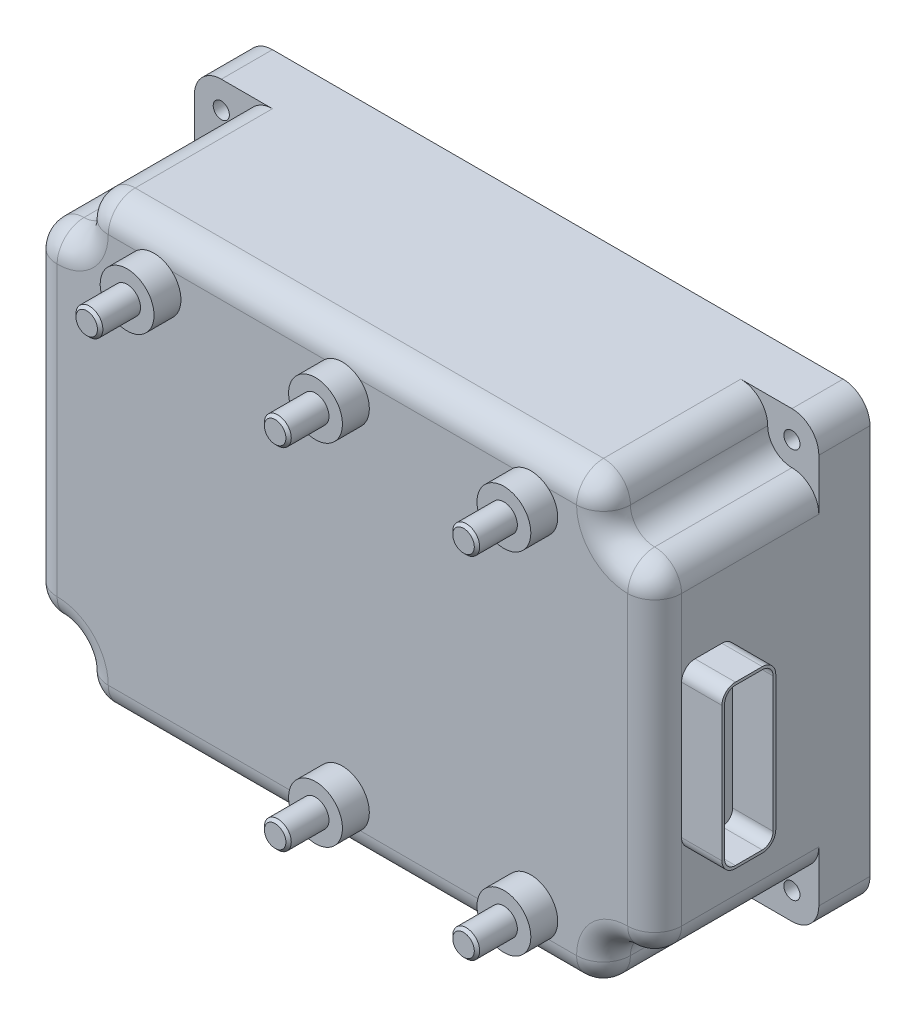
SolidWorks part; units mm, degrees
ref_plane "Face" through (0, 0, 0) normal (0, 0, 1) x (1, 0, 0)
ref_plane "Dessus" through (0, 0, 0) normal (0, 1, 0) x (1, 0, 0)
ref_plane "Droite" through (0, 0, 0) normal (1, 0, 0) x (0, 0, -1)
sketch "Esquisse1" plane through (0, 0, 0) normal (0, 0, 1) x (1, 0, 0)
  line L1 (-106, 82.5) -> (106, 82.5)
  line L2 (-116, 72.5) -> (-116, -72.5)
  line L3 (-106, -82.5) -> (106, -82.5)
  line L4 (116, 72.5) -> (116, -72.5)
  circle A0 centre (-106, 72.5) radius 3
  circle A1 centre (-106, -72.5) radius 3
  circle A2 centre (106, -72.5) radius 3
  circle A3 centre (106, 72.5) radius 3
  arc A4 (-116, 72.5) -> (-106, 82.5) centre (-106, 72.5) cw
  arc A5 (-106, -82.5) -> (-116, -72.5) centre (-106, -72.5) cw
  arc A6 (116, -72.5) -> (106, -82.5) centre (106, -72.5) cw
  arc A7 (106, 82.5) -> (116, 72.5) centre (106, 72.5) cw
  point P15 (-116, 82.5)
  point P18 (-116, -82.5)
  point P23 (116, 82.5)
  dimension "D5" = 6
  dimension "D10" = 10
  dimension "D1" = 232
  dimension "D2" = 165
  dimension "D3" = 116
  dimension "D4" = 82.5
  dimension "D6" = 212
  dimension "D7" = 106
  dimension "D8" = 145
  dimension "D9" = 72.5
extrude "Extrusion1" add sketch "Esquisse1" along normal blind 19
sketch "Esquisse2" plane through (0, 0, 19) normal (0, 0, 1) x (1, 0, 0)
  line L1 (-87, 82.5) -> (87, 82.5)
  line L2 (-116, 53.5) -> (-116, -53.5)
  line L3 (-87, -82.5) -> (87, -82.5)
  line L4 (116, 53.5) -> (116, -53.5)
  arc A0 (-106, 63.5) -> (-97, 72.5) centre (-106, 72.5) ccw
  arc A1 (-97, -72.5) -> (-106, -63.5) centre (-106, -72.5) ccw
  arc A2 (106, -63.5) -> (97, -72.5) centre (106, -72.5) ccw
  arc A3 (97, 72.5) -> (106, 63.5) centre (106, 72.5) ccw
  arc A4 (-87, 82.5) -> (-97, 72.5) centre (-87, 72.5) ccw
  arc A5 (-116, 53.5) -> (-106, 63.5) centre (-106, 53.5) cw
  arc A6 (-116, -53.5) -> (-106, -63.5) centre (-106, -53.5) ccw
  arc A7 (-87, -82.5) -> (-97, -72.5) centre (-87, -72.5) cw
  arc A8 (87, -82.5) -> (97, -72.5) centre (87, -72.5) ccw
  arc A9 (116, -53.5) -> (106, -63.5) centre (106, -53.5) cw
  arc A10 (116, 53.5) -> (106, 63.5) centre (106, 53.5) ccw
  arc A11 (87, 82.5) -> (97, 72.5) centre (87, 72.5) cw
  dimension "D5" = 18
  dimension "D6" = 10
  dimension "D1" = 212
  dimension "D2" = 145
  dimension "D3" = 72.5
  dimension "D4" = 106
extrude "Extrusion2" add sketch "Esquisse2" along normal blind 61
fillet "Congé1" radius 10
sketch "Esquisse3" plane through (0, 0, 80) normal (0, 0, 1) x (1, 0, 0)
  circle A0 centre (-70, 65) radius 10
  circle A1 centre (0, 65) radius 10
  circle A2 centre (70, 65) radius 10
  circle A3 centre (70, -65) radius 10
  circle A4 centre (0, -65) radius 10
  dimension "D1" = 20
  dimension "D2" = 70
  dimension "D3" = 70
  dimension "D4" = 70
  dimension "D5" = 130
  dimension "D6" = 65
extrude "Extrusion3" add sketch "Esquisse3" along normal blind 10
sketch "Esquisse4" plane through (0, 0, 90) normal (0, 0, 1) x (1, 0, 0)
  circle A0 centre (-70, 65) radius 5
  circle A1 centre (0, 65) radius 5
  circle A2 centre (70, 65) radius 5
  circle A3 centre (70, -65) radius 5
  circle A4 centre (0, -65) radius 5
  dimension "D1" = 10
extrude "Extrusion4" add sketch "Esquisse4" along normal blind 15
chamfer "Chanfrein1" distance 1 angle 45
sketch "Esquisse5" plane through (116, 0, 0) normal (1, 0, 0) x (0, 0, -1)
  line L0 (-80, -53.5) -> (-80, 53.5) construction
  line L1 (-65, -30) -> (-55, -30)
  line L2 (-70, -25) -> (-70, 25)
  line L3 (-65, 30) -> (-55, 30)
  line L4 (-50, -25) -> (-50, 25)
  arc A0 (-65, -30) -> (-70, -25) centre (-65, -25) cw
  arc A1 (-50, -25) -> (-55, -30) centre (-55, -25) cw
  arc A2 (-55, 30) -> (-50, 25) centre (-55, 25) cw
  arc A3 (-70, 25) -> (-65, 30) centre (-65, 25) cw
  point P8 (-70, -30)
  point P15 (-70, 30)
  dimension "D5" = 5
  dimension "D1" = 60
  dimension "D2" = 20
  dimension "D3" = 10
  dimension "D4" = 30
extrude "Extru.-Mince1" add sketch "Esquisse5" along normal blind 15 thin
